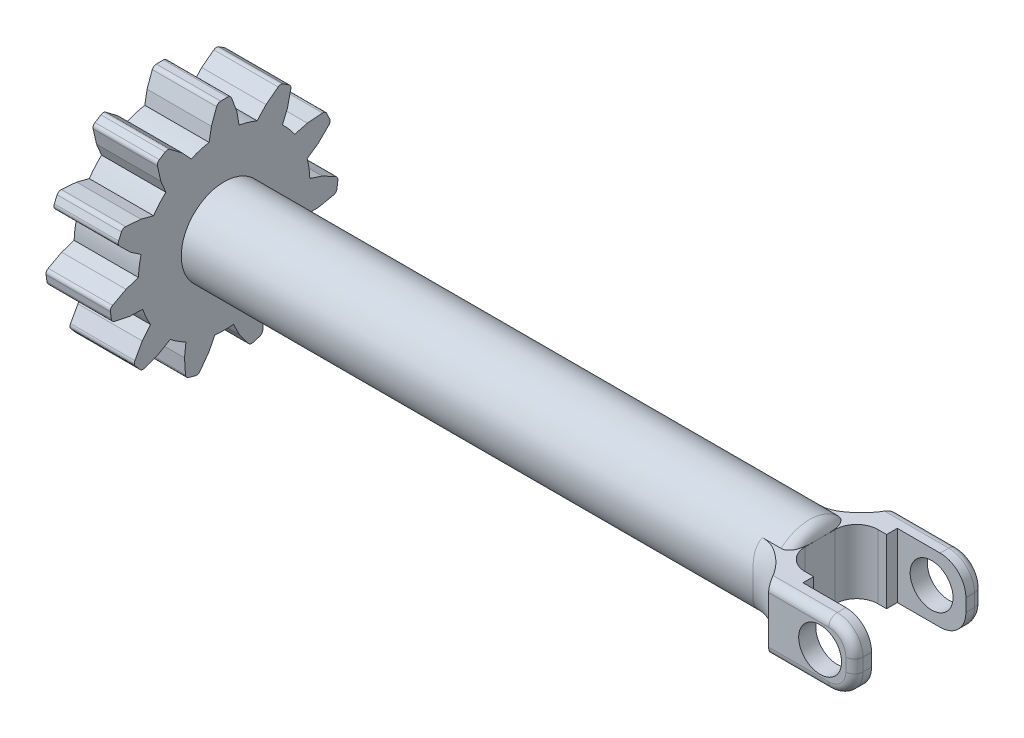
SolidWorks part; units mm, degrees
ref_plane "Front Plane" through (0, 0, 0) normal (0, 0, 1) x (1, 0, 0)
ref_plane "Top Plane" through (0, 0, 0) normal (0, 1, 0) x (1, 0, 0)
ref_plane "Right Plane" through (0, 0, 0) normal (1, 0, 0) x (0, 0, -1)
sketch "Sketch1" plane through (0, 0, 0) normal (1, 0, 0) x (0, 0, -1)
  circle A0 centre (0, 0) radius 25.4
  dimension "D1" = 50.8
extrude "Boss-Extrude1" add sketch "Sketch1" along normal blind 19.05
sketch "Sketch8" plane through (19.05, 0, 0) normal (1, 0, 0) x (0, 0, -1)
  circle A0 centre (0, 0) radius 12.7
  dimension "D1" = 25.4
extrude "Boss-Extrude4" add sketch "Sketch8" along normal blind 180.34
sketch "Sketch9" plane through (199.39, 0, 0) normal (1, 0, 0) x (0, 0, -1)
  line L1 (-19.05, 9.525) -> (19.05, 9.525)
  line L2 (-19.05, 9.525) -> (-19.05, -9.525)
  line L3 (-19.05, -9.525) -> (19.05, -9.525)
  line L4 (19.05, 9.525) -> (19.05, -9.525)
  dimension "D1" = 19.05
  dimension "D2" = 9.525
  dimension "D3" = 19.05
  dimension "D4" = 19.05
extrude "Boss-Extrude5" add sketch "Sketch9" along normal blind 25.4
sketch "Sketch10" plane through (0, 9.525, 0) normal (0, 1, 0) x (1, 0, 0)
  line L0 (224.79, 19.05) -> (224.79, -19.05) construction
  line L1 (224.79, 13.97) -> (204.47, 13.97)
  line L2 (224.79, 13.97) -> (224.79, -13.97)
  line L3 (224.79, -13.97) -> (204.47, -13.97)
  line L4 (204.47, 13.97) -> (204.47, -13.97)
  line L5 (199.39, -8.4003) -> (199.39, 8.4003) construction
  line L6 (224.79, 19.05) -> (199.39, 19.05) construction
  line L7 (224.79, -19.05) -> (199.39, -19.05) construction
  dimension "D1" = 5.08
  dimension "D2" = 5.08
  dimension "D3" = 5.08
extrude "Cut-Extrude3" cut sketch "Sketch10" against normal blind 25.4
sketch "Sketch11" plane through (0, 0, 19.05) normal (0, 0, 1) x (1, 0, 0)
  line L0 (224.79, -9.525) -> (199.39, -9.525) construction
  line L1 (224.79, 9.525) -> (224.79, -9.525) construction
  circle A0 centre (214.63, 0) radius 6.35
  dimension "D1" = 12.7
  dimension "D2" = 9.525
  dimension "D3" = 10.16
extrude "Cut-Extrude4" cut sketch "Sketch11" against normal blind 38.1
fillet "Fillet1" radius 7.62 4 edges at (224.79, -9.525, -16.51) (224.79, -9.525, 16.51) (224.79, 9.525, 16.51) (224.79, 9.525, -16.51)
fillet "Fillet2" radius 12.7 2 edges at (199.39, 0, -12.7) (199.39, 0, 12.7)
sketch "Sketch12" plane through (204.47, 0, 0) normal (1, 0, 0) x (0, 0, -1)
  line L1 (-10.795, 12.7) -> (10.795, 12.7)
  line L2 (-10.795, 12.7) -> (-10.795, -12.7)
  line L3 (-10.795, -12.7) -> (10.795, -12.7)
  line L4 (10.795, 12.7) -> (10.795, -12.7)
  arc A0 (8.4003, 9.525) -> (-8.4003, 9.525) centre (0, 0) ccw construction
  arc A1 (-8.4003, -9.525) -> (8.4003, -9.525) centre (0, 0) ccw construction
  point P4 (0, -12.7)
  dimension "D1" = 21.59
extrude "Cut-Extrude5" cut sketch "Sketch12" against normal blind 8.89
fillet "Fillet3" radius 3.175 2 edges at (195.58, -12.7, 0) (195.58, 12.7, 0)
fillet "Fillet4" radius 6.35 2 edges at (195.58, 0, -10.795) (195.58, 0, 10.795)
fillet "Fillet5" radius 2.54 5 edges at (208.28, -9.525, 19.05) (222.5582, -7.2932, 19.05) (224.79, 0, 19.05) (208.28, 9.525, 19.05) (222.5582, 7.2932, 19.05)
fillet "Fillet6" radius 2.54 5 edges at (208.28, 9.525, -19.05) (208.28, -9.525, -19.05) (222.5582, -7.2932, -19.05) (224.79, 0, -19.05) (222.5582, 7.2932, -19.05)
sketch "Sketch13" plane through (0, 0, 0) normal (-1, 0, 0) x (0, 0, 1)
  line L0 (-4.445, 25.008) -> (4.445, 25.008)
  line L1 (4.445, 25.008) -> (3.7732, 28.818)
  line L2 (3.7732, 28.818) -> (2.2284, 33.0624)
  line L3 (1.035, 33.898) -> (-1.035, 33.898)
  line L4 (-2.2284, 33.0624) -> (-3.7732, 28.818)
  line L5 (-3.7732, 28.818) -> (-4.445, 25.008)
  circle A0 centre (0, 0) radius 25.4 construction
  arc A1 (2.2284, 33.0624) -> (1.035, 33.898) centre (1.035, 32.628) ccw
  arc A2 (-1.035, 33.898) -> (-2.2284, 33.0624) centre (-1.035, 32.628) ccw
  point P13 (-1.9242, 33.898)
  dimension "D6" = 1.27
  dimension "D1" = 3.81
  dimension "D2" = 5.08
  dimension "D3" = 8.89
  dimension "D4" = 80
  dimension "D5" = 110
extrude "Boss-Extrude6" add sketch "Sketch13" against normal blind 19.05
pattern_circular "CirPattern1" count 11 over 360 about axis through (0, 0, 0) along (1, 0, 0) of "Boss-Extrude6"
ref_plane "Plane1" through (120.65, 0, 0) normal (1, 0, 0) x (0, 0, -1)
sketch "Sketch14" plane through (120.65, 0, 0) normal (1, 0, 0) x (0, 0, -1)
  circle A0 centre (0, 0) radius 176.2859
